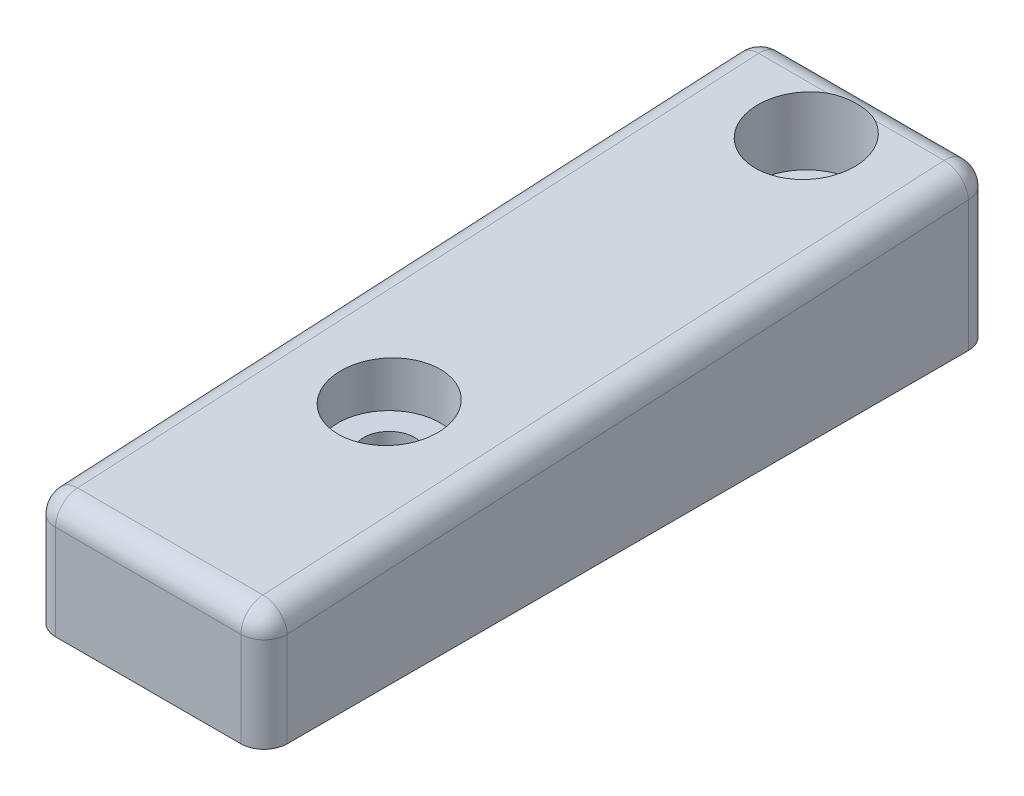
SolidWorks part; units mm, degrees
ref_plane "Plan de face" through (0, 0, 0) normal (0, 0, 1) x (1, 0, 0)
ref_plane "Plan de dessus" through (0, 0, 0) normal (0, 1, 0) x (1, 0, 0)
ref_plane "Plan de droite" through (0, 0, 0) normal (1, 0, 0) x (0, 0, -1)
sketch "Esquisse1" plane through (0, 0, 0) normal (1, 0, 0) x (0, 0, -1)
  line L0 (0, 0) -> (0, 25.21)
  line L1 (0, 25.21) -> (157, 33.438)
  line L2 (157, 33.438) -> (157, 0)
  line L3 (157, 0) -> (0, 0)
  dimension "D1" = 3
  dimension "D2" = 157
  dimension "D3" = 25.21
extrude "Extrusion1" add sketch "Esquisse1" along normal blind 50
fillet "Congé1" radius 5 2 edges at (25, 33.438, -157) (25, 25.21, 0)
fillet "Congé2" radius 5 10 edges at (0, 14.0846, -157) (0, 31.796, -155.4418) (0, 10.2326, 0) (0, 23.907, -1.3731) (50, 14.0846, -157) (50, 31.796, -155.4418) (50, 10.2326, 0) (50, 23.907, -1.3731) (0, 29.3103, -78.2383) (50, 29.3103, -78.2383)
ref_plane "Plan1" through (0, 18.5, 0) normal (0, -1, 0) x (1, 0, 0)
sketch "Esquisse2" plane through (0, 18.5, 1.1437) normal (0, 1, 0) x (1, 0, 0)
  line L0 (25, 152.882) -> (25, 5.882) construction
  line L1 (45, 152.882) -> (5, 152.882) construction
  line L2 (5, 5.882) -> (45, 5.882) construction
  line L4 (45, 1.1437) -> (5, 1.1437) construction
  line L5 (5, 158.1437) -> (45, 158.1437) construction
  circle A0 centre (25, 143.1437) radius 11
  circle A1 centre (25, 53.1437) radius 11
  dimension "D1" = 22
  dimension "D2" = 22
  dimension "D3" = 15
  dimension "D4" = 52
extrude "Extrusion3" cut sketch "Esquisse2" along normal blind 43
sketch "Esquisse3" plane through (0, 18.5, 0) normal (0, 1, 0) x (1, 0, 0)
  circle A0 centre (25, 52) radius 5.5
  circle A1 centre (25, 142) radius 5.5
  dimension "D1" = 11
  dimension "D2" = 11
extrude "Extrusion4" cut sketch "Esquisse3" against normal blind 43
